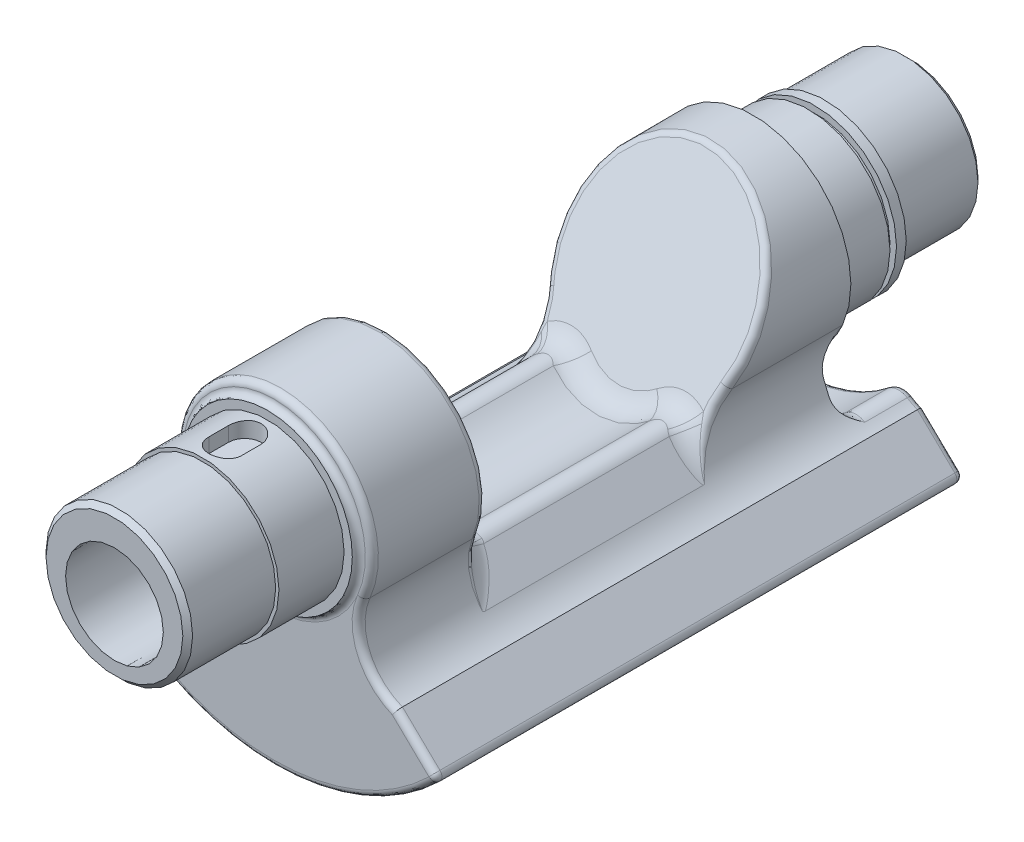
SolidWorks part; units mm, degrees
ref_plane "Plan de face" through (0, 0, 0) normal (0, 0, 1) x (1, 0, 0)
ref_plane "Plan de dessus" through (0, 0, 0) normal (0, 1, 0) x (1, 0, 0)
ref_plane "Plan de droite" through (0, 0, 0) normal (1, 0, 0) x (0, 0, -1)
other "Centre de masse"
sketch "Esquisse1" plane through (0, 0, 0) normal (0, 0, 1) x (1, 0, 0)
  line L0 (0, 0) -> (0, -127.4904) construction
  line L1 (-50.3538, -48.6261) -> (0, 0) construction
  line L2 (0, 0) -> (50.3538, -48.6261) construction
  line L3 (-50.3538, -48.6261) -> (-37.4057, -36.1222)
  line L4 (50.3538, -48.6261) -> (37.4057, -36.1222)
  arc A0 (-50.3538, -48.6261) -> (50.3538, -48.6261) centre (0, 0) ccw
  arc A1 (-27.4555, -12.0911) -> (27.4555, -12.0911) centre (0, 0) cw
  arc A2 (-27.4555, -12.0911) -> (-37.4057, -36.1222) centre (-43.9288, -19.3458) cw
  arc A3 (27.4555, -12.0911) -> (37.4057, -36.1222) centre (43.9288, -19.3458) ccw
  dimension "D1" = 30
  dimension "D2" = 70
  dimension "D6" = 18
  dimension "D3" = 92
  dimension "D5" = 18
extrude "Boss.-Extru.1" add sketch "Esquisse1" against normal blind 162
sketch "Esquisse2" plane through (0, 0, 0) normal (0, 0, 1) x (1, 0, 0)
  circle A0 centre (0, 0) radius 26
  dimension "D1" = 52
extrude "Boss.-Extru.2" add sketch "Esquisse2" along normal blind 2
sketch "Esquisse3" plane through (0, 0, 2) normal (0, 0, 1) x (1, 0, 0)
  circle A0 centre (0, 0) radius 23.5
  dimension "D1" = 47
extrude "Boss.-Extru.3" add sketch "Esquisse3" along normal blind 20
sketch "Esquisse4" plane through (0, 0, 22) normal (0, 0, 1) x (1, 0, 0)
  circle A0 centre (0, 0) radius 22.5
  dimension "D1" = 45
extrude "Boss.-Extru.4" add sketch "Esquisse4" along normal blind 27
chamfer "Chanfrein1" distance 1.5 angle 45 1 edges at (22.5, 0, 49)
fillet "Congé1" radius 2 6 edges at (-43.8797, -42.3742, 0) (-27.298, -26.2318, 0) (0, -70, 0) (43.8797, -42.3742, 0) (27.298, -26.2318, 0) (0, 30, 0)
fillet "Congé2" radius 2 1 edges at (26, 0, 0)
ref_plane "Plan1" through (0, 18.5, 0) normal (0, 1, 0) x (1, 0, 0)
sketch "Esquisse5" plane through (0, 18.5, 0) normal (0, 1, 0) x (1, 0, 0)
  line L0 (0, -9) -> (0, -15) construction
  line L1 (5, -9) -> (5, -15)
  line L2 (-5, -9) -> (-5, -15)
  line L4 (-22.5, -22) -> (22.5, -22) construction
  arc A0 (5, -9) -> (-5, -9) centre (0, -9) ccw
  arc A1 (-5, -15) -> (5, -15) centre (0, -15) ccw
  point P3 (0, -12)
  dimension "D1" = 10
  dimension "D2" = 6
  dimension "D3" = 7
extrude "Enlèv. mat.-Extru.2" cut sketch "Esquisse5" along normal through all
ref_plane "Plan2" through (0, 0, -81) normal (0, 0, 1) x (1, 0, 0)
ref_plane "Plan3" through (0, 0, -36) normal (0, 0, 1) x (1, 0, 0)
ref_plane "Plan4" through (0, 0, -101) normal (0, 0, 1) x (1, 0, 0)
sketch "Esquisse10" plane through (0, 0, -36) normal (0, 0, 1) x (1, 0, 0)
  line L0 (21.9754, -30) -> (-17.7674, -30) construction
  dimension "D1" = 30
sketch "Esquisse11" plane through (0, 0, -101) normal (0, 0, 1) x (1, 0, 0)
  line L0 (-17.2998, -30) -> (21.9754, -30) construction
  dimension "D1" = 30
ref_plane "Plan7" through (0, 1.2191, -34.9098) normal (0, -0.0349, 0.9994) x (1, 0, 0)
ref_plane "Plan8" through (0, -48.4785, -91.1748) normal (0, 0.4695, 0.8829) x (1, 0, 0)
sketch "Esquisse9" plane through (0, 0, -81) normal (0, 0, 1) x (1, 0, 0)
  line L0 (18, -17.8786) -> (30, -30.747)
  line L1 (-30, 0) -> (-30, -30.747)
  line L2 (-18, -17.8786) -> (-30, -30.747)
  line L3 (30, 0) -> (30, -30.747)
  line L4 (-30, 0) -> (30, 0) construction
  line L5 (-18, -17.8786) -> (18, -17.8786) construction
  line L6 (-30, -30.747) -> (30, -30.747) construction
  arc A0 (-30, 0) -> (30, 0) centre (0, 0) cw
  arc A1 (-18, -17.8786) -> (18, -17.8786) centre (0, 0) ccw
  dimension "D2" = 25.3702
  dimension "D3" = 30
  dimension "D1" = 43
  dimension "D4" = 18
extrude "Enlèv. mat.-Extru.3" cut sketch "Esquisse9" along normal up to surface and the other way up to surface
fillet "Congé4" radius 5 2 edges at (-18, -17.8786, -71.5109) (18, -17.8786, -71.5109)
fillet "Congé5" radius 2 6 edges at (-26.0939, -21.7783, -35.7129) (26.0939, -21.7783, -35.7129) (0, 30, -33.9048) (-26.0939, -21.7783, -105.3715) (26.0939, -21.7783, -105.3715) (0, 30, -132.9026)
fillet "Congé6" radius 8 14 edges at (29.9439, -30.6869, -102.0705) (23.2773, -23.5378, -104.436) (18.0891, -19.7884, -106.4296) (-29.723, -30.45, -101.9993) (-23.2773, -23.5378, -104.436) (-18.0891, -19.7884, -106.4296) (0, -25.3702, -103.4617) (-29.8961, -30.6357, -34.269) (-23.0327, -23.2755, -35.7652) (-18.0891, -19.7884, -35.6434) (29.5898, -30.3072, -34.4901) (23.0327, -23.2755, -35.7652) (18.0891, -19.7884, -35.6434) (0, -25.3702, -35.8383)
sketch "Esquisse12" plane through (0, 0, -162) normal (0, 0, -1) x (-1, 0, 0)
  line L2 (50.3538, -48.6261) -> (37.4057, -36.1222)
  line L3 (-37.4057, -36.1222) -> (-50.3538, -48.6261)
  arc A0 (31.3817, -32.252) -> (-31.3817, -32.252) centre (0, 0) cw
  arc A4 (-50.3538, -48.6261) -> (50.3538, -48.6261) centre (0, 0) ccw
  arc A5 (27.4555, -12.0911) -> (37.4057, -36.1222) centre (43.9288, -19.3458) ccw
  arc A6 (27.4555, -12.0911) -> (-27.4555, -12.0911) centre (0, 0) ccw
  arc A7 (-37.4057, -36.1222) -> (-27.4555, -12.0911) centre (-43.9288, -19.3458) ccw
  arc A9 (27.4555, -12.0911) -> (31.3817, -32.252) centre (43.9288, -19.3458) ccw
  arc A10 (27.4555, -12.0911) -> (-27.4555, -12.0911) centre (0, 0) ccw
  arc A11 (-31.3817, -32.252) -> (-27.4555, -12.0911) centre (-43.9288, -19.3458) ccw
  dimension "D2" = 45
  dimension "D3" = 18
  dimension "D1" = 0
extrude "Enlèv. mat.-Extru.4" cut sketch "Esquisse12" against normal blind 20
fillet "Congé7" radius 2 6 edges at (-43.8797, -42.3742, -162) (-34.1993, -34.4897, -162) (0, -45, -162) (34.1993, -34.4897, -162) (43.8797, -42.3742, -162) (0, -70, -162)
fillet "Congé8" radius 2 6 edges at (-49.99, -48.6321, -160.9809) (-49.99, -48.6321, -1.0191) (49.99, -48.6321, -160.9809) (49.99, -48.6321, -1.0191) (-50.3538, -48.6261, -81) (50.3538, -48.6261, -81)
sketch "Esquisse13" plane through (0, 0, -142) normal (0, 0, -1) x (-1, 0, 0)
  circle A0 centre (0, 0) radius 30
  dimension "D1" = 60
extrude "Boss.-Extru.5" add sketch "Esquisse13" along normal blind 5
fillet "Congé10" radius 5 4 edges at (31.3825, -32.6209, -160.9962) (-31.3825, -32.6209, -160.9962) (-31.3817, -32.252, -151) (31.3817, -32.252, -151)
fillet "Congé9" radius 5 4 edges at (0, -30, -142) (0, -45, -142) (-31.2965, -33.7649, -142) (31.2965, -33.7649, -142)
sketch "Esquisse14" plane through (0, 0, -147) normal (0, 0, -1) x (-1, 0, 0)
  line L0 (0, 0) -> (0, -15.6682) construction
  circle A0 centre (0, -2) radius 25
  dimension "D2" = 50
  dimension "D1" = 2
extrude "Boss.-Extru.6" add sketch "Esquisse14" along normal blind 22
sketch "Esquisse15" plane through (0, 0, -169) normal (0, 0, -1) x (-1, 0, 0)
  circle A0 centre (0, 0) radius 22.5
  dimension "D1" = 45
extrude "Boss.-Extru.7" add sketch "Esquisse15" along normal blind 26
chamfer "Chanfrein2" distance 1.5 angle 45 1 edges at (-22.5, 0, -195)
sketch "Esquisse16" plane through (0, 0, 0) normal (1, 0, 0) x (0, 0, -1)
  line L0 (147, -2) -> (169, -2) construction
  line L1 (147, -27) -> (147, 23) construction
  line L2 (169, -27) -> (169, 23) construction
  line L4 (164, 26.1348) -> (166, 26.1348)
  line L5 (164, 26.1348) -> (164, 21)
  line L6 (164, 21) -> (166, 21)
  line L7 (166, 26.1348) -> (166, 21)
  dimension "D1" = 3
  dimension "D2" = 2
  dimension "D3" = 23
revolve "Enlèvement de matière-Révolution1" cut sketch "Esquisse16" angle 360 about L0
sketch "Esquisse17" plane through (0, 0, 49) normal (0, 0, 1) x (1, 0, 0)
  line L0 (0, 0) -> (0, -18.0097) construction
  circle A0 centre (0, -2) radius 15
  dimension "D1" = 30
  dimension "D2" = 2
extrude "Enlèv. mat.-Extru.6" cut sketch "Esquisse17" against normal up to next
